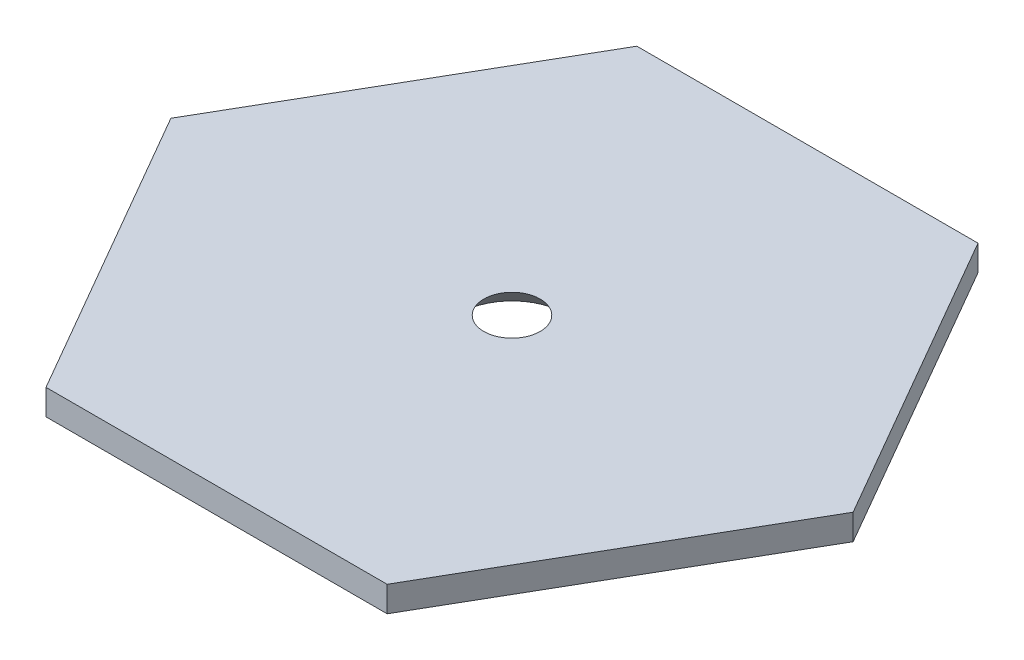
SolidWorks part; units mm, degrees
ref_plane "Front" through (0, 0, 0) normal (0, 0, 1) x (1, 0, 0)
ref_plane "Top" through (0, 0, 0) normal (0, 1, 0) x (1, 0, 0)
ref_plane "Right" through (0, 0, 0) normal (1, 0, 0) x (0, 0, -1)
sketch "Sketch3" plane through (0, 0, 0) normal (0, 1, 0) x (1, 0, 0)
  line L1 (40, 0) -> (20, 34.641)
  line L2 (20, 34.641) -> (-20, 34.641)
  line L3 (-20, 34.641) -> (-40, 0)
  line L4 (-40, 0) -> (-20, -34.641)
  line L5 (-20, -34.641) -> (20, -34.641)
  line L6 (20, -34.641) -> (40, 0)
  circle A0 centre (0, 0) radius 40 construction
extrude "Extrude1" add sketch "Sketch3" along normal blind 3
hole_wizard "CSK for M6 Countersunk Flat Head Screw2" positions "3DSketch2" profile "Sketch5" countersink size "M6" standard "DIN"
sketch3d "3DSketch2"
  point P0 (0, 0, 0)
sketch "Sketch5" plane through (0, 0, 0) normal (1, 0, 0) x (0, 0, -1)
  line L0 (0, 0) -> (0, 3)
  line L1 (0, 3) -> (3.2, 3)
  line L2 (3.2, 3) -> (3.2, 3.1)
  line L3 (3.2, 3.1) -> (6.3, 0)
  line L5 (6.3, 0) -> (0, 0)
  line L6 (-3.2, 3.1) -> (-6.3, 0) construction
  line L11 (0, -6.35) -> (0, 107.95) construction
  dimension "Thru Hole Dia." = 6.4
  dimension "Thru Hole Depth" = 3
  dimension "Near C'Sink Dia." = 12.6
  dimension "Near C'Sink Angle" = 90
